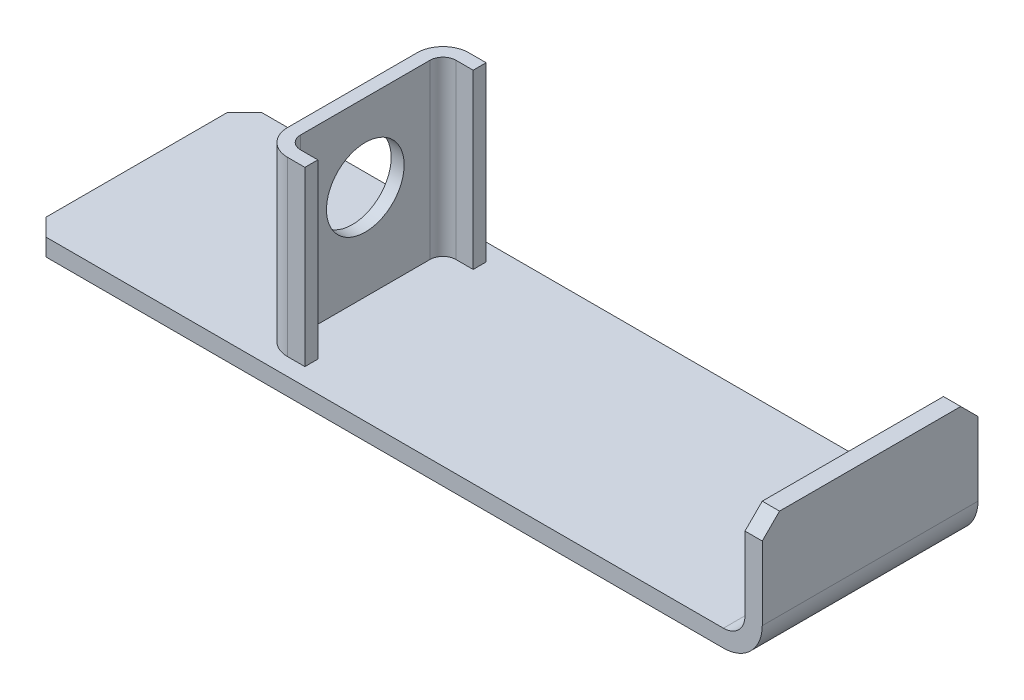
SolidWorks part; units mm, degrees
ref_plane "Plan de face" through (0, 0, 0) normal (0, 0, 1) x (1, 0, 0)
ref_plane "Plan de dessus" through (0, 0, 0) normal (0, 1, 0) x (1, 0, 0)
ref_plane "Plan de droite" through (0, 0, 0) normal (1, 0, 0) x (0, 0, -1)
sketch "Esquisse1" plane through (0, 0, 0) normal (0, 0, 1) x (1, 0, 0)
  line L0 (-170, 0) -> (0, 0)
  line L1 (0, 0) -> (0, 30)
  dimension "D1" = 170
  dimension "D2" = 30
extrude "Extru.-Mince1" add sketch "Esquisse1" along normal mid plane 50 thin
sketch "Esquisse2" plane through (0, 4, 0) normal (0, 1, 0) x (-1, 0, 0)
  line L0 (120, -21) -> (120, 21)
  line L1 (120, 21) -> (110, 21)
  line L2 (120, -21) -> (110, -21)
  line L3 (170, 25) -> (170, -25) construction
  dimension "D1" = 42
  dimension "D2" = 10
  dimension "D3" = 50
  dimension "D4" = 21
extrude "Extru.-Mince2" add sketch "Esquisse2" along normal blind 40 thin
sketch "Esquisse3" plane through (-117, 0, 0) normal (1, 0, 0) x (0, 0, -1)
  line L0 (-15, 4) -> (15, 4) construction
  circle A0 centre (0, 26) radius 9
  dimension "D1" = 18
  dimension "D2" = 22
extrude "Enlèv. mat.-Extru.1" cut sketch "Esquisse3" against normal up to next
chamfer "Chanfrein1" distance 4 angle 45 4 edges at (-170, 2, -25) (-170, 2, 25) (-2, 30, -25) (-2, 30, 25)
